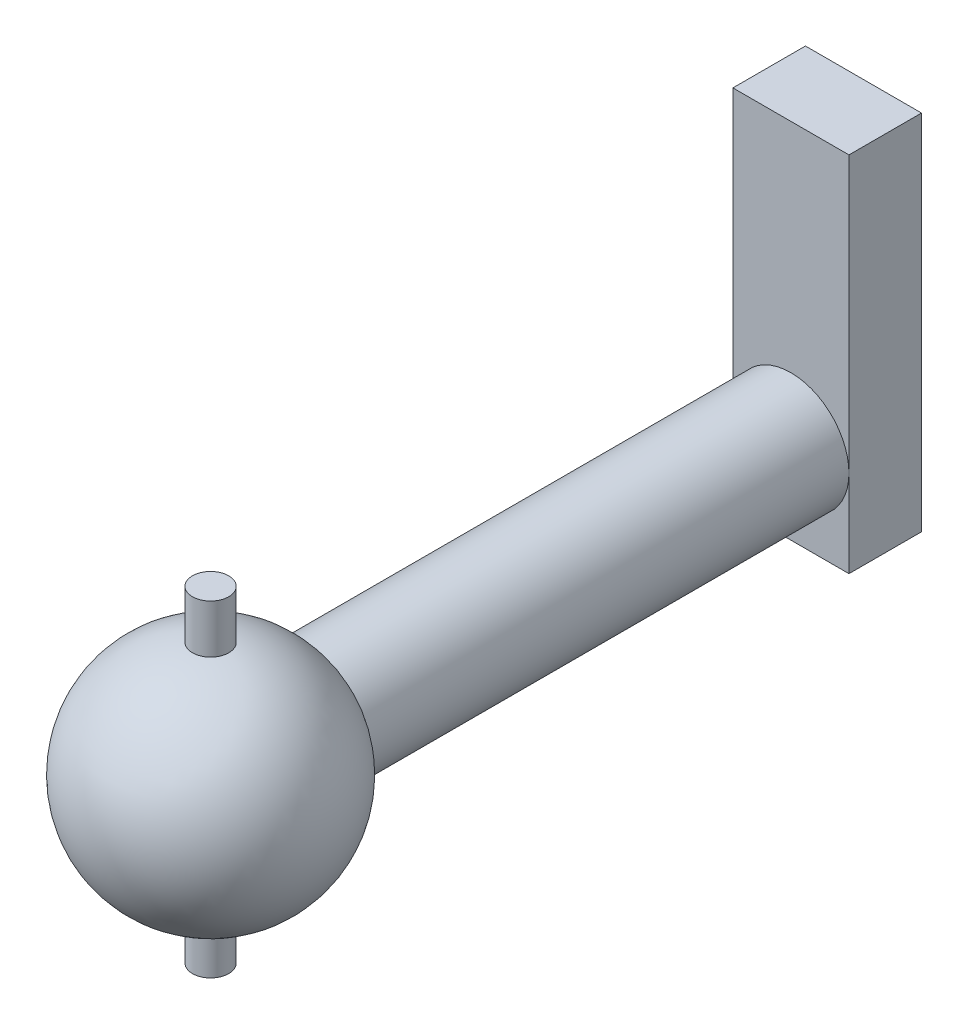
SolidWorks part; units mm, degrees
ref_plane "Plan de face" through (0, 0, 0) normal (0, 0, 1) x (1, 0, 0)
ref_plane "Plan de dessus" through (0, 0, 0) normal (0, 1, 0) x (1, 0, 0)
ref_plane "Plan de droite" through (0, 0, 0) normal (1, 0, 0) x (0, 0, -1)
sketch "Esquisse1" plane through (0, 0, 0) normal (0, 0, 1) x (1, 0, 0)
  circle A0 centre (0, 0) radius 8
extrude "Boss.-Extru.1" add sketch "Esquisse1" along normal blind 80
sketch "Esquisse2" plane through (0, 0, 0) normal (0, 0, -1) x (-1, 0, 0)
  line L1 (-8, -12) -> (8, -12)
  line L2 (-8, -12) -> (-8, 38)
  line L3 (-8, 38) -> (8, 38)
  line L4 (8, -12) -> (8, 38)
  dimension "D1" = 16
  dimension "D2" = 8
  dimension "D3" = 50
  dimension "D4" = 12
extrude "Boss.-Extru.2" add sketch "Esquisse2" along normal blind 10
ref_plane "Plan1" through (0, 0, 10) normal (0, 0, 1) x (1, 0, 0)
sketch "Esquisse3" plane through (0, 0, 10) normal (0, 0, 1) x (1, 0, 0)
  circle A0 centre (0, 0) radius 22
sketch "Esquisse4" plane through (0, 0, 80) normal (0, 0, 1) x (1, 0, 0)
  line L0 (0, 16) -> (0, -16)
  line L1 (0, 19.825) -> (0, -20.368) construction
  arc A0 (0, -16) -> (0, 16) centre (0, 0) ccw
revolve "Révolution1" add sketch "Esquisse4" angle 360 about L1
sketch "Esquisse5" plane through (0, 0, 0) normal (0, 1, 0) x (1, 0, 0)
  circle A0 centre (0, -80) radius 2.5
extrude "Boss.-Extru.3" add sketch "Esquisse5" along normal mid plane 45
